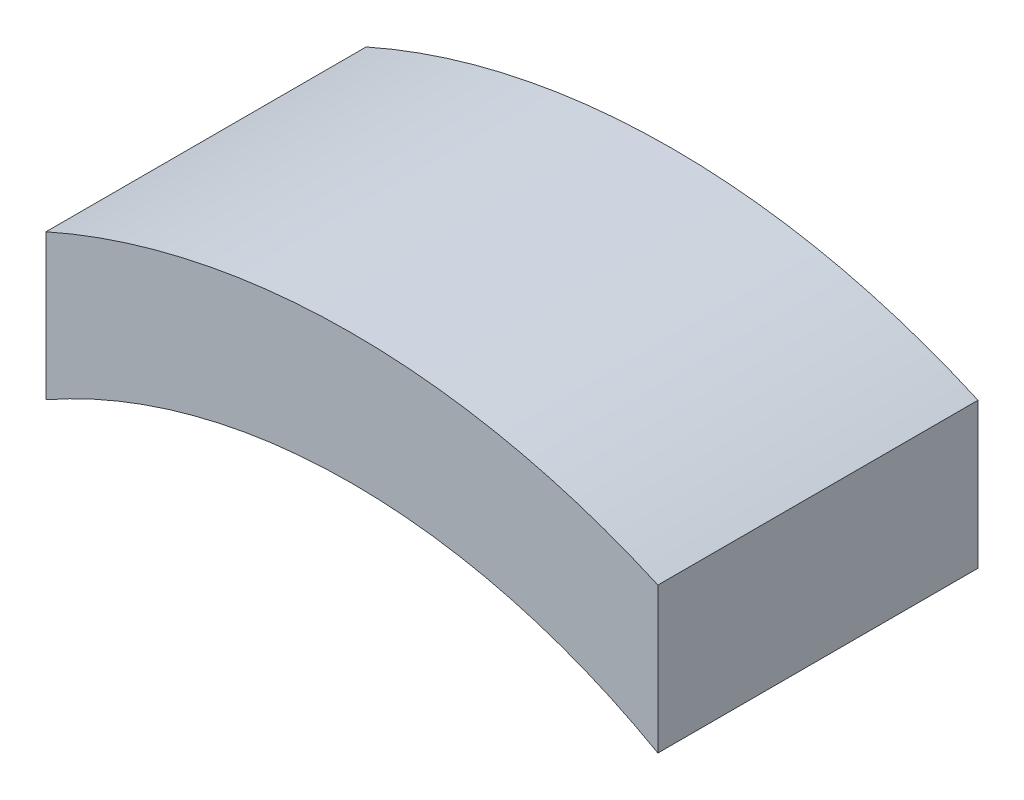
SolidWorks part; units mm, degrees
ref_plane "Front" through (0, 0, 0) normal (0, 0, 1) x (1, 0, 0)
ref_plane "Top" through (0, 0, 0) normal (0, 1, 0) x (1, 0, 0)
ref_plane "Right" through (0, 0, 0) normal (1, 0, 0) x (0, 0, -1)
sketch "Sketch1" plane through (0, 0, 0) normal (0, 0, 1) x (1, 0, 0)
  line L0 (67.5123, 0) -> (67.5123, -32.7276)
  line L1 (67.5123, -32.7276) -> (-70.1305, -32.7276) construction
  line L2 (-70.1305, -32.7276) -> (-70.1305, 0)
  arc A0 (-70.1305, 0) -> (67.5123, 0) centre (-1.3091, -154.2921) cw
  arc A1 (-70.1305, -32.7276) -> (67.5123, -32.7276) centre (-1.3091, -154.2921) cw
extrude "Extrude1" add sketch "Sketch1" along normal mid plane 72
surface "Surface-MidSurface3" parameters "D0"=50000
